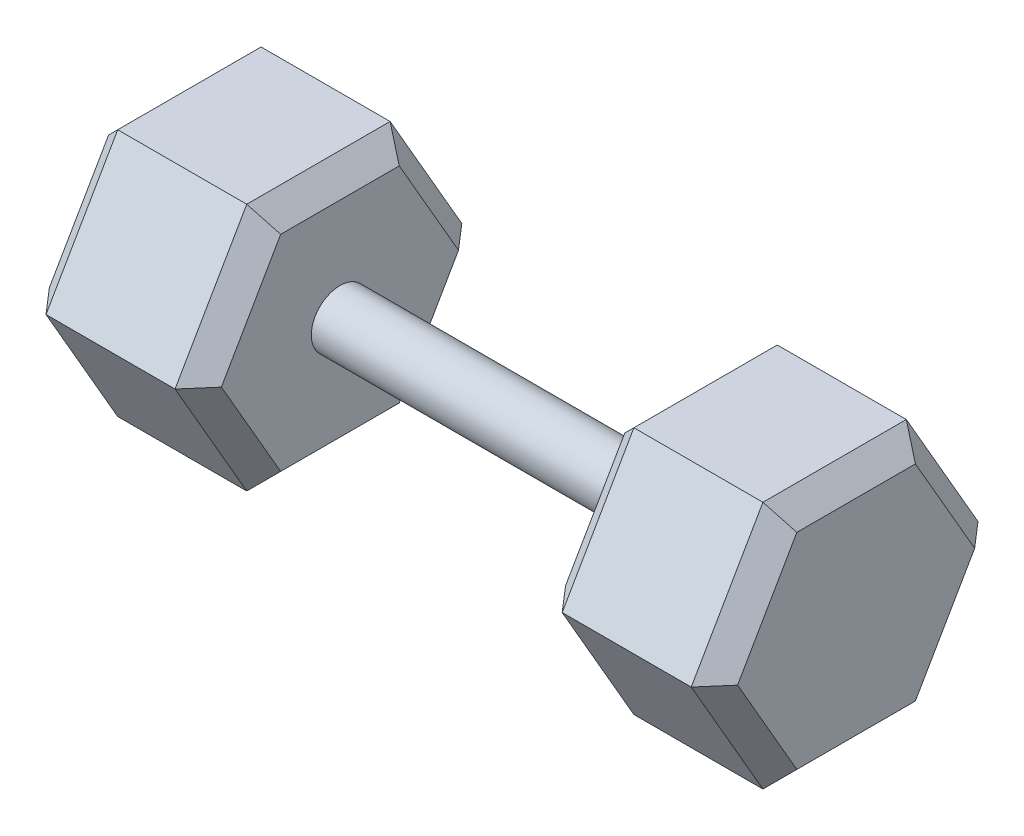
SolidWorks part; units mm, degrees
ref_plane "Front" through (0, 0, 0) normal (0, 0, 1) x (1, 0, 0)
ref_plane "Top" through (0, 0, 0) normal (0, 1, 0) x (1, 0, 0)
ref_plane "Right" through (0, 0, 0) normal (1, 0, 0) x (0, 0, -1)
sketch "Sketch1" plane through (0, 0, 0) normal (1, 0, 0) x (0, 0, -1)
  line L1 (63.5, 0) -> (31.75, 54.9926)
  line L2 (31.75, 54.9926) -> (-31.75, 54.9926)
  line L3 (-31.75, 54.9926) -> (-63.5, 0)
  line L4 (-63.5, 0) -> (-31.75, -54.9926)
  line L5 (-31.75, -54.9926) -> (31.75, -54.9926)
  line L6 (31.75, -54.9926) -> (63.5, 0)
  circle A0 centre (0, 0) radius 54.9926 construction
  dimension "D1" = 127
extrude "Base-Extrude" add sketch "Sketch1" along normal blind 76.2
chamfer "Chamfer1" distance 9.525 angle 45 12 edges at (76.2, 54.9926, 0) (76.2, 27.4963, 47.625) (76.2, -27.4963, 47.625) (76.2, -54.9926, 0) (76.2, -27.4963, -47.625) (0, -54.9926, 0) (0, -27.4963, 47.625) (0, 27.4963, 47.625) (0, 54.9926, 0) (76.2, 27.4963, -47.625) (0, 27.4963, -47.625) (0, -27.4963, -47.625)
sketch "Sketch2" plane through (76.2, 0, 0) normal (1, 0, 0) x (0, 0, -1)
  circle A0 centre (0, 0) radius 12.6913
extrude "Boss-Extrude1" add sketch "Sketch2" along normal blind 76.2
mirror "Mirror All1" about plane through (152.4, 0, 0) normal (1, 0, 0)
